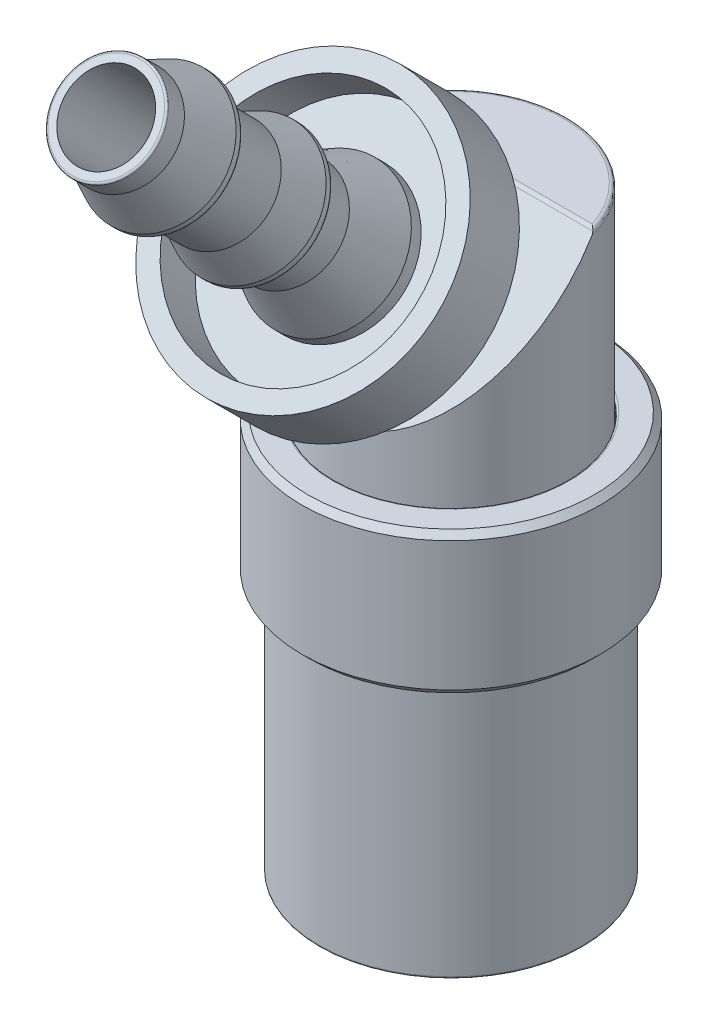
SolidWorks part; units mm, degrees
other "Body"
ref_plane "Front Plane" through (0, 0, 0) normal (0, 0, 1) x (1, 0, 0)
ref_plane "Top Plane" through (0, 0, 0) normal (0, 1, 0) x (1, 0, 0)
ref_plane "Right Plane" through (0, 0, 0) normal (1, 0, 0) x (0, 0, -1)
imported_body "SC200S"
imported_body "BODY"
imported_body "PL-BARB"
imported_body "BARB"
imported_body "SLEEVE"
sketch "Sketch1" plane through (0, 0, 0) normal (1, 0, 0) x (0, 0, -1)
  line L0 (-4.7752, 8.1191) -> (-3.175, 7.1952)
  line L1 (-3.175, 7.1952) -> (-3.175, 2.3876)
  line L2 (-3.175, 2.3876) -> (-4.7752, 0.7874)
  line L3 (-4.7752, 0.7874) -> (-4.7752, 8.1191)
  line L4 (0, 7.7378) -> (0, -2.1158) construction
  line L5 (-5.0546, 8.2804) -> (-4.7752, 8.1191) construction
  line L6 (-5.5626, 0) -> (-4.7752, 0.7874) construction
  dimension "D1" = 6.35
revolve "Revolve1" add sketch "Sketch1" angle 360 about L4
sketch "Sketch2" plane through (0, 0, 0) normal (0, -1, 0) x (1, 0, 0)
  line L1 (0, 5.2793) -> (-4.572, 2.6396)
  line L2 (-4.572, 2.6396) -> (-4.572, -2.6396)
  line L3 (-4.572, -2.6396) -> (0, -5.2793)
  line L4 (0, -5.2793) -> (4.572, -2.6396)
  line L5 (4.572, -2.6396) -> (4.572, 2.6396)
  line L6 (4.572, 2.6396) -> (0, 5.2793)
  circle A0 centre (0, 0) radius 4.572 construction
  dimension "D1" = 9.144
extrude "Cut-Extrude1" cut sketch "Sketch2" against normal up to surface (9.3379 mm away)
